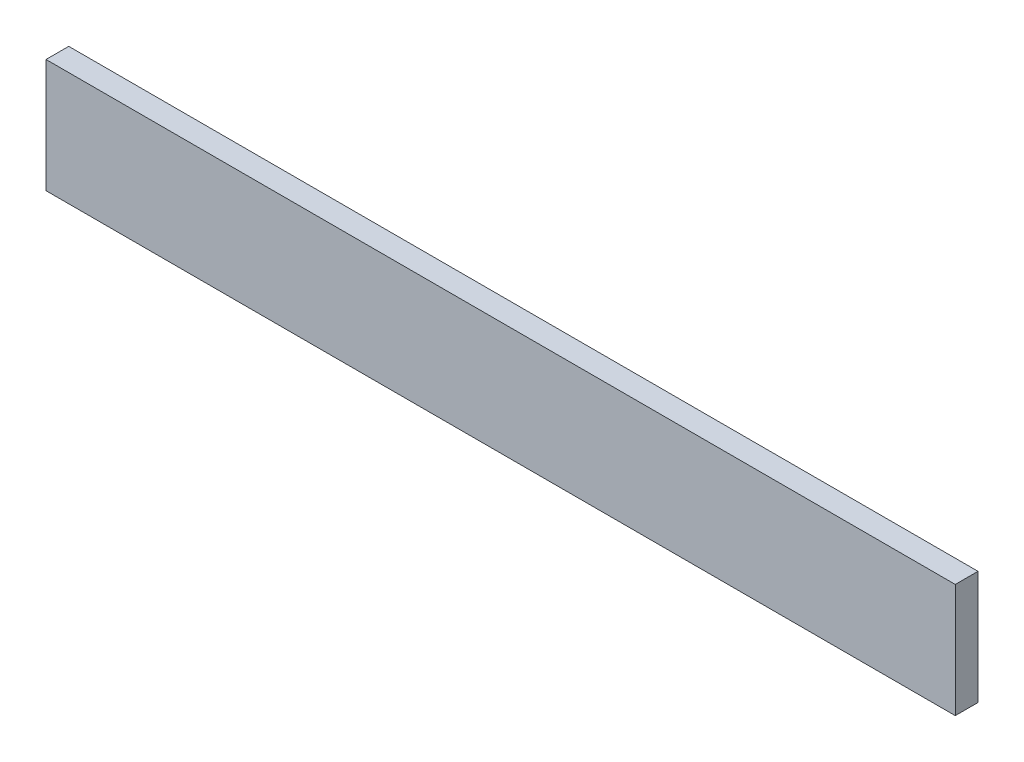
SolidWorks part; units mm, degrees
ref_plane "Front Plane" through (0, 0, 0) normal (0, 0, 1) x (1, 0, 0)
ref_plane "Top Plane" through (0, 0, 0) normal (0, 1, 0) x (1, 0, 0)
ref_plane "Right Plane" through (0, 0, 0) normal (1, 0, 0) x (0, 0, -1)
sketch "Sketch1" plane through (0, 0, 0) normal (0, 1, 0) x (1, 0, 0)
  line L1 (0, 0) -> (101.6, 0)
  line L2 (0, 0) -> (0, 2.54)
  line L3 (0, 2.54) -> (101.6, 2.54)
  line L4 (101.6, 0) -> (101.6, 2.54)
  dimension "D1" = 2.54
  dimension "D2" = 101.6
extrude "Extrude1" add sketch "Sketch1" along normal blind 12.7
